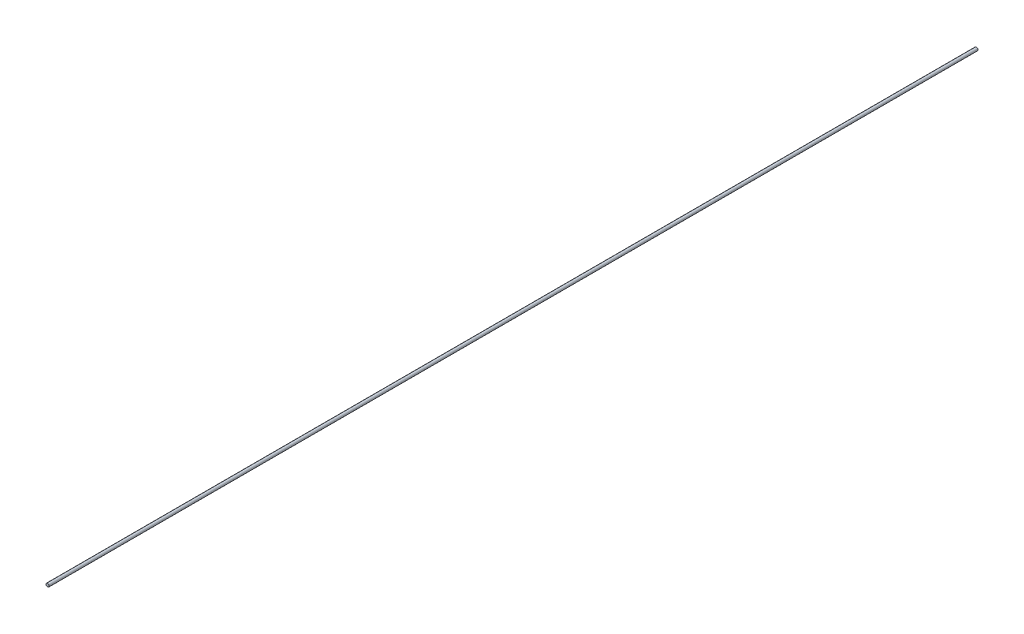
SolidWorks part; units mm, degrees
ref_plane "Plane1" through (0, 0, 0) normal (0, 0, 1) x (1, 0, 0)
ref_plane "Plane2" through (0, 0, 0) normal (0, 1, 0) x (1, 0, 0)
ref_plane "Plane3" through (0, 0, 0) normal (1, 0, 0) x (0, 0, -1)
sketch "Sketch1" plane through (0, 0, 0) normal (0, 0, 1) x (1, 0, 0)
  circle A0 centre (0, 0) radius 1.5875
  dimension "D1" = 3.175
extrude "Base-Extrude" add sketch "Sketch1" along normal blind 914.4
